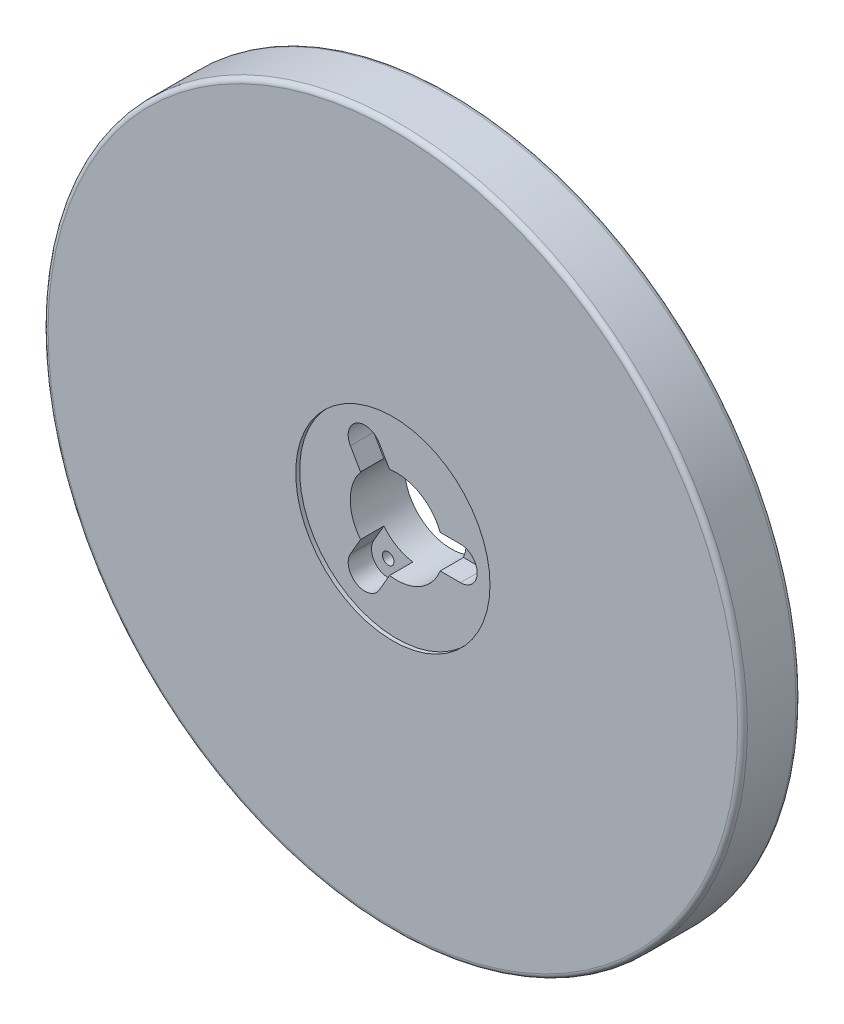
SolidWorks part; units mm, degrees
ref_plane "Front Plane" through (0, 0, 0) normal (0, 0, 1) x (1, 0, 0)
ref_plane "Top Plane" through (0, 0, 0) normal (0, 1, 0) x (1, 0, 0)
ref_plane "Right Plane" through (0, 0, 0) normal (1, 0, 0) x (0, 0, -1)
sketch "Sketch1" plane through (0, 0, 0) normal (0, 0, 1) x (1, 0, 0)
  circle A0 centre (0, 0) radius 228.6
  dimension "D1" = 457.2
extrude "Extrude1" add sketch "Sketch1" along normal mid plane 38.1
sketch "Sketch2" plane through (0, 0, 19.05) normal (0, 0, 1) x (1, 0, 0)
  circle A0 centre (0, 0) radius 30.4165
  dimension "D1" = 60.833
extrude "Cut-Extrude1" cut sketch "Sketch2" against normal through all
fillet "Fillet1" radius 3.175 1 edges at (228.6, 0, 19.05)
fillet "Fillet2" radius 3.175 1 edges at (228.6, 0, -19.05)
sketch "Sketch4" plane through (0, 0, 19.05) normal (0, 0, 1) x (1, 0, 0)
  circle A0 centre (0, 0) radius 63.5
  dimension "D1" = 127
extrude "Cut-Extrude3" cut sketch "Sketch4" against normal blind 2.54
sketch "Sketch5" plane through (0, 0, -19.05) normal (0, 0, -1) x (-1, 0, 0)
  circle A0 centre (-152.4, 0) radius 50.8
  dimension "D1" = 101.6
  dimension "D2" = 152.4
extrude "Cut-Extrude4" [suppressed] cut sketch "Sketch5" against normal through all
pattern_circular "CirPattern2" [suppressed] count 6 every 60
sketch "Sketch10" plane through (0, 0, 16.51) normal (0, 0, 1) x (1, 0, 0)
  line L0 (41.656, -10.922) -> (28.3879, -10.922)
  line L1 (41.656, 10.922) -> (28.3879, 10.922)
  line L2 (28.3879, 10.922) -> (28.3879, -10.922)
  arc A0 (41.656, -10.922) -> (41.656, 10.922) centre (41.656, 0) ccw
  circle A2 centre (0, 0) radius 30.4165 construction
  dimension "D1" = 21.844
  dimension "D2" = 41.656
  dimension "D3" = 21.844
extrude "Cut-Extrude6" cut sketch "Sketch10" against normal blind 15.24 and the other way through all
sketch "Sketch11" plane through (0, 0, -19.05) normal (0, 0, -1) x (-1, 0, 0)
  circle A0 centre (-41.656, 0) radius 9.525
  dimension "D1" = 19.05
extrude "Cut-Extrude7" cut sketch "Sketch11" against normal blind 12.7
sketch "Sketch12" plane through (0, 0, -6.35) normal (0, 0, -1) x (-1, 0, 0)
  circle A0 centre (-41.656, 0) radius 3.81
  dimension "D1" = 7.62
extrude "Cut-Extrude8" cut sketch "Sketch12" against normal through all
pattern_circular "CirPattern3" count 3 every 120 about axis through (0, 0, 0) along (0, 0, 1) of "Cut-Extrude8", "Cut-Extrude7", "Cut-Extrude6"
